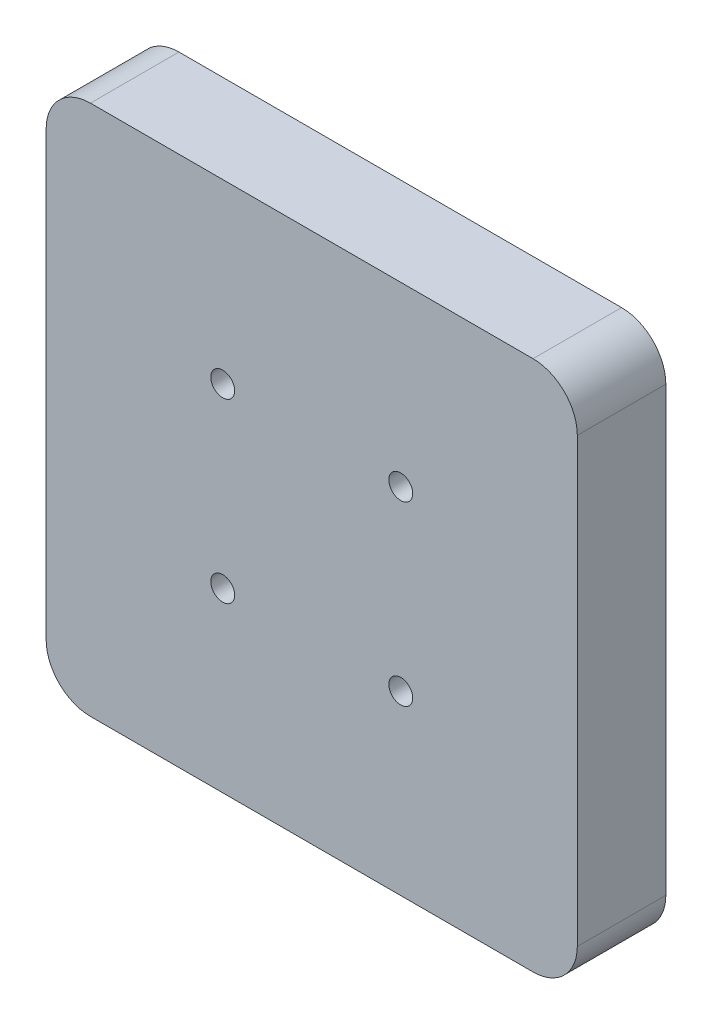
SolidWorks part; units mm, degrees
ref_plane "Front Plane" through (0, 0, 0) normal (0, 0, 1) x (1, 0, 0)
ref_plane "Top Plane" through (0, 0, 0) normal (0, 1, 0) x (1, 0, 0)
ref_plane "Right Plane" through (0, 0, 0) normal (1, 0, 0) x (0, 0, -1)
sketch "Sketch3" plane through (0, 0, 0) normal (0, 0, 1) x (1, 0, 0)
  line L60 (50, -93.4042) -> (50, -33.4042)
  line L61 (50, -33.4042) -> (-70, -33.4042)
  line L62 (-70, -33.4042) -> (-70, -153.4042)
  line L63 (-70, -153.4042) -> (50, -153.4042)
  line L64 (50, -153.4042) -> (50, -93.4042)
  circle A0 centre (-30.1133, -73.4042) radius 2.7
  circle A1 centre (10.1133, -73.4042) radius 2.7
  circle A2 centre (10.1133, -113.4042) radius 2.7
  circle A3 centre (-30.1133, -113.4042) radius 2.7
extrude "Boss-Extrude2" add sketch "Sketch3" along normal blind 6
sketch "Sketch4" plane through (0, 0, 0) normal (0, 0, -1) x (-1, 0, 0)
  line L4 (70, -93.4042) -> (70, -33.4042)
  line L5 (70, -33.4042) -> (-50, -33.4042)
  line L6 (-50, -33.4042) -> (-50, -153.4042)
  line L7 (-50, -153.4042) -> (70, -153.4042)
  line L8 (70, -153.4042) -> (70, -93.4042)
  circle A0 centre (-10.1133, -73.4042) radius 5
  circle A1 centre (30.1133, -73.4042) radius 5
  circle A2 centre (30.1133, -113.4042) radius 5
  circle A3 centre (-10.1133, -113.4042) radius 5
extrude "Boss-Extrude3" add sketch "Sketch4" along normal blind 4
sketch "Sketch6" plane through (0, 0, -4) normal (0, 0, -1) x (-1, 0, 0)
  line L8 (65, -148.4042) -> (65, -38.4042)
  line L9 (65, -38.4042) -> (-45, -38.4042)
  line L10 (-45, -38.4042) -> (-45, -148.4042)
  line L11 (-45, -148.4042) -> (65, -148.4042)
  line L12 (65, -148.4042) -> (65, -38.4042)
  line L13 (65, -38.4042) -> (-45, -38.4042)
  line L14 (-45, -38.4042) -> (-45, -148.4042)
  line L15 (-45, -148.4042) -> (65, -148.4042)
  line L16 (70, -153.4042) -> (70, -33.4042)
  line L17 (70, -33.4042) -> (-50, -33.4042)
  line L18 (-50, -33.4042) -> (-50, -153.4042)
  line L19 (-50, -153.4042) -> (70, -153.4042)
  line L20 (70, -153.4042) -> (70, -33.4042)
  line L21 (70, -33.4042) -> (-50, -33.4042)
  line L22 (-50, -33.4042) -> (-50, -153.4042)
  line L23 (-50, -153.4042) -> (70, -153.4042)
  dimension "D1" = 5
  dimension "D2" = 0
extrude "Boss-Extrude4" add sketch "Sketch6" along normal blind 10
fillet "Fillet1" radius 10 8 edges at (45, -148.4042, -9) (45, -38.4042, -9) (-65, -148.4042, -9) (-65, -38.4042, -9) (-70, -153.4042, -4) (-70, -33.4042, -4) (50, -33.4042, -4) (50, -153.4042, -4)
